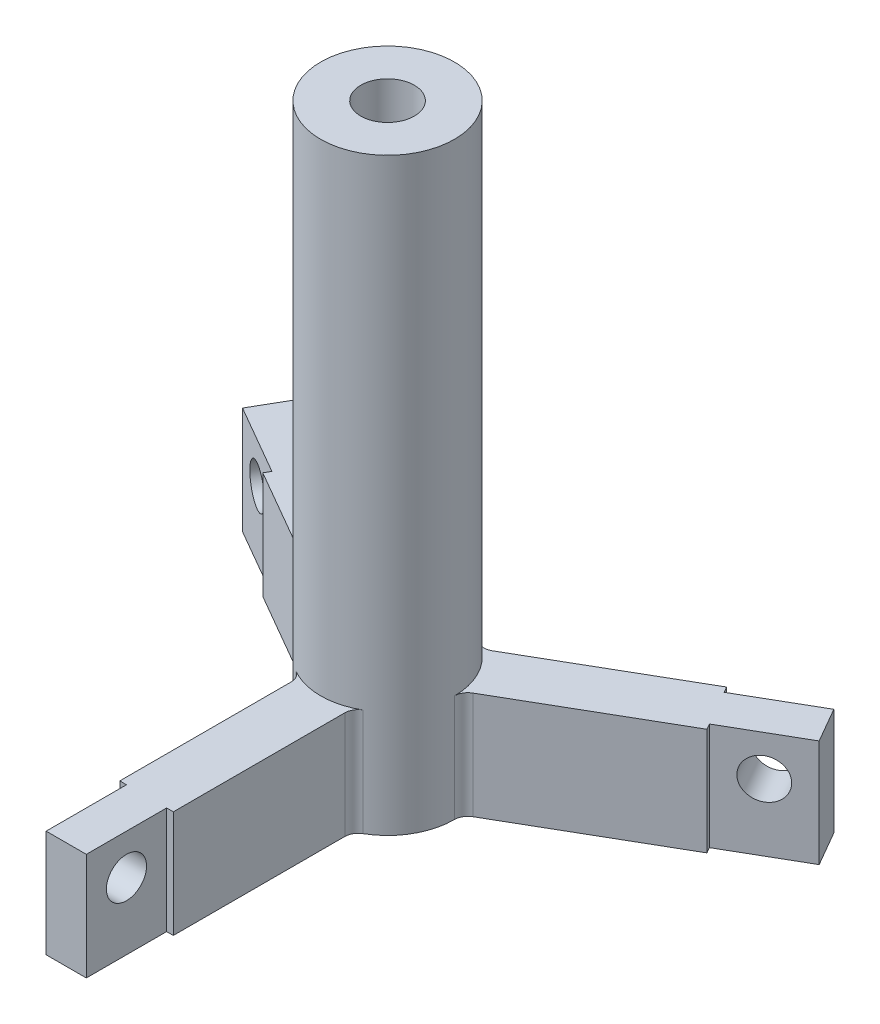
SolidWorks part; units mm, degrees
ref_plane "Front" through (0, 0, 0) normal (0, 0, 1) x (1, 0, 0)
ref_plane "Top" through (0, 0, 0) normal (0, 1, 0) x (1, 0, 0)
ref_plane "Right" through (0, 0, 0) normal (1, 0, 0) x (0, 0, -1)
sketch "Sketch1" plane through (0, 0, 0) normal (0, 0, 1) x (1, 0, 0)
  line L0 (0, 118.2237) -> (0, -58.1736) construction
  line L1 (12.7, 0) -> (12.7, 127)
  line L2 (12.7, 127) -> (6.35, 127)
  line L3 (6.35, 127) -> (6.35, 139.7)
  line L4 (6.35, 139.7) -> (15.875, 139.7)
  line L5 (15.875, 139.7) -> (15.875, 0)
  line L6 (15.875, 0) -> (12.7, 0)
  dimension "D1" = 25.4
  dimension "D2" = 31.75
  dimension "D3" = 12.7
  dimension "D4" = 139.7
  dimension "D5" = 127
revolve "Base-Revolve" add sketch "Sketch1" angle 360 about L0
ref_plane "Plane1" through (0, 0, 76.2) normal (0, 0, 1) x (1, 0, 0)
sketch "Sketch2" plane through (0, 0, 76.2) normal (0, 0, 1) x (1, 0, 0)
  line L1 (-4.7625, 0) -> (4.7625, 0)
  line L2 (-4.7625, 0) -> (-4.7625, 25.4)
  line L3 (-4.7625, 25.4) -> (4.7625, 25.4)
  line L4 (4.7625, 0) -> (4.7625, 25.4)
  point P4 (0, 0)
  dimension "D1" = 25.4
  dimension "D2" = 9.525
extrude "Boss-Extrude1" add sketch "Sketch2" against normal up to surface (61.0562 mm away)
sketch "Sketch3" plane through (4.7625, 0, 0) normal (1, 0, 0) x (0, 0, -1)
  line L0 (-76.2, 0) -> (-76.2, 25.4) construction
  line L1 (-15.1438, 25.4) -> (-76.2, 25.4) construction
  circle A0 centre (-66.675, 15.875) radius 4.7625
  dimension "D1" = 9.525
  dimension "D2" = 9.525
  dimension "D3" = 9.525
extrude "Cut-Extrude1" cut sketch "Sketch3" against normal through all
ref_plane "Plane2" through (0, 0, 57.15) normal (0, 0, 1) x (1, 0, 0)
sketch "Sketch4" plane through (0, 0, 57.15) normal (0, 0, 1) x (1, 0, 0)
  line L0 (4.7625, 25.4) -> (-4.7625, 25.4) construction
  line L1 (6.35, 0) -> (-6.35, 0)
  line L2 (6.35, 0) -> (6.35, 25.4)
  line L3 (6.35, 25.4) -> (-6.35, 25.4)
  line L4 (-6.35, 0) -> (-6.35, 25.4)
  point P4 (0, 0)
  dimension "D1" = 12.7
extrude "Boss-Extrude2" add sketch "Sketch4" against normal up to surface (42.6003 mm away)
fillet "Fillet1" radius 3.175 2 edges at (-6.35, 12.7, 14.5497) (6.35, 12.7, 14.5497)
pattern_circular "CirPattern1" count 3 over 360 about axis through (0, 0, 0) along (0, 1, 0) of "Fillet1", "Boss-Extrude2", "Cut-Extrude1", "Boss-Extrude1"
ref_plane "Plane3" through (0, 0, -15.875) normal (0, 0, 1) x (1, 0, 0)
sketch "Sketch5" plane through (0, 0, -15.875) normal (0, 0, 1) x (1, 0, 0)
  line L0 (0, 118.2237) -> (0, -58.1736) construction
  circle A0 centre (0, 38.1) radius 7.9375
  dimension "D1" = 15.875
  dimension "D2" = 38.1
extrude "Cut-Extrude3" cut sketch "Sketch5" along normal blind 0.635
sketch "Sketch6" plane through (0, 0, -15.24) normal (0, 0, -1) x (-1, 0, 0)
  circle A0 centre (0, 38.1) radius 3.175
  arc A1 (4.445, 44.6762) -> (-4.445, 44.6762) centre (0, 38.1) ccw construction
  dimension "D1" = 6.35
extrude "Cut-Extrude4" cut sketch "Sketch6" against normal blind 12.7
